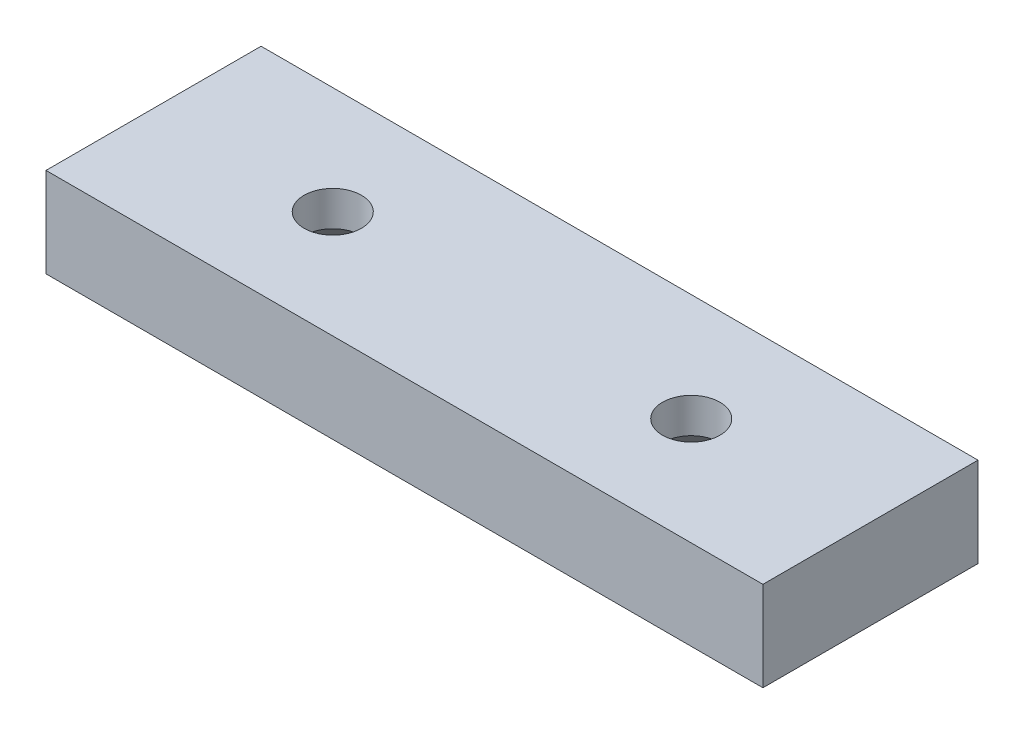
SolidWorks part; units mm, degrees
ref_plane "Plan1" through (0, 0, 0) normal (0, 0, 1) x (1, 0, 0)
ref_plane "Plan2" through (0, 0, 0) normal (0, 1, 0) x (1, 0, 0)
ref_plane "Plan3" through (0, 0, 0) normal (1, 0, 0) x (0, 0, -1)
sketch "Esquisse1" plane through (0, 0, 0) normal (0, 1, 0) x (1, 0, 0)
  line L1 (0, -12) -> (80, -12)
  line L2 (0, -12) -> (0, 12)
  line L3 (0, 12) -> (80, 12)
  line L4 (80, -12) -> (80, 12)
  dimension "D1" = 80
  dimension "D2" = 24
extrude "BASE" add sketch "Esquisse1" along normal blind 10
hole_wizard "Fraisage pour vis à tête fraisée à fond plat M61" positions "Esquisse3" profile "Esquisse2" countersink size "M6" standard "ISO"
sketch "Esquisse3" plane through (0, 0, 0) normal (0, -1, 0) x (1, 0, 0)
  line L0 (0, -12) -> (0, 12) construction
  point P0 (20, 0)
  point P1 (60, 0)
  dimension "D1" = 20
  dimension "D2" = 40
sketch "Esquisse2" plane through (20, 0, 0) normal (1, 0, 0) x (0, 0, -1)
  line L0 (0, 0) -> (0, 10)
  line L1 (0, 10) -> (3.2, 10)
  line L2 (3.2, 10) -> (3.2, 6.1)
  line L3 (3.2, 6.1) -> (6.3, 3)
  line L4 (6.3, 3) -> (6.3, 0)
  line L6 (6.3, 0) -> (0, 0)
  line L7 (-3.2, 6.1) -> (-6.3, 3) construction
  line L11 (0, -6.35) -> (0, 107.95) construction
  dimension "Diamètre du perçage jusqu'au prochain" = 6.4
  dimension "Profondeur du perçage jusqu'au prochain" = 10
  dimension "Diamètre du fraisage" = 12.6
  dimension "Angle du fraisage" = 90
  dimension "Dégagement de la tête" = 3
sketch "Esquisse4" plane through (0, 0, 0) normal (0, -1, 0) x (1, 0, 0)
  line L0 (80, 12) -> (80, -12) construction
  point P8 (40, 0)
  dimension "D1" = 40
